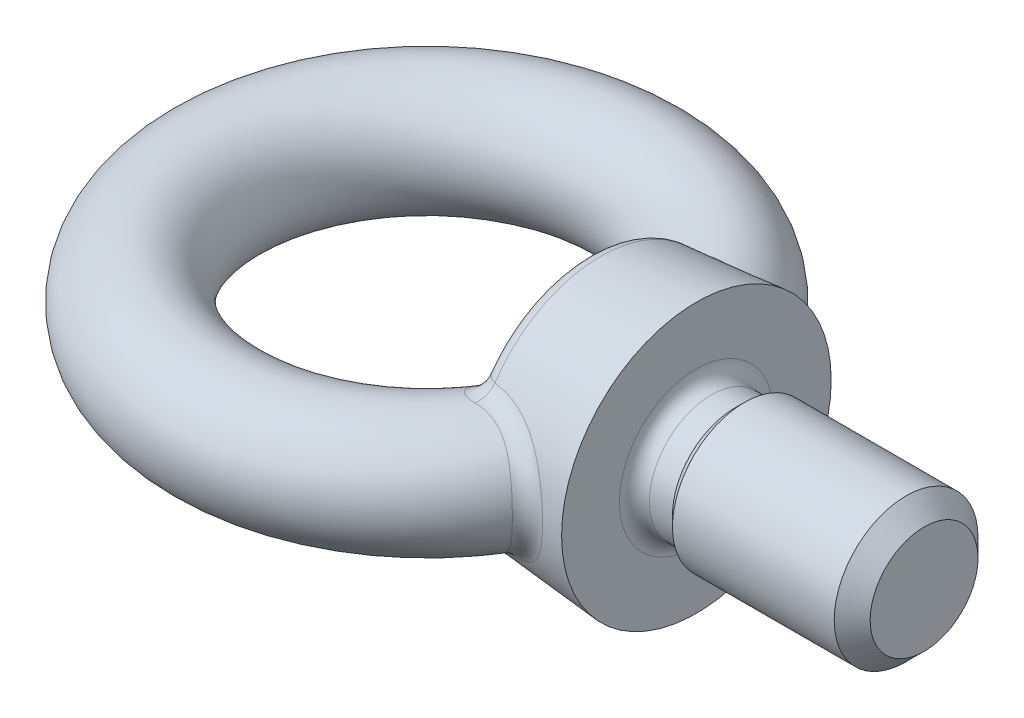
SolidWorks part; units mm, degrees
ref_plane "Front Plane" through (0, 0, 0) normal (0, 0, 1) x (1, 0, 0)
ref_plane "Top Plane" through (0, 0, 0) normal (0, 1, 0) x (1, 0, 0)
ref_plane "Right Plane" through (0, 0, 0) normal (1, 0, 0) x (0, 0, -1)
sketch "BaseBodySke" plane through (0, 0, 0) normal (0, 0, 1) x (1, 0, 0)
  line L0 (-107.4075, 0) -> (214.0904, 0) construction
  line L1 (0, 0) -> (0, 10.352)
  line L2 (8, 12) -> (6.352, 10.352)
  line L3 (6.352, 10.352) -> (0, 10.352)
  line L4 (8, 12) -> (38, 12)
  line L5 (38, 12) -> (38, 0)
  line L6 (38, 0) -> (0, 0)
  line L7 (8, 24.2031) -> (8, -17.9005) construction
  line L8 (34.0602, 10.352) -> (57.5082, 10.352) construction
  line L9 (35, 13.8049) -> (35, -14.5195) construction
  dimension "D2" = 45
  dimension "Diameter" = 24
  dimension "Length" = 38
  dimension "Thread_length" = 30
  dimension "Minor_dia" = 20.704
  dimension "Advance" = 3
  dimension "Slot_width" = 8
revolve "BaseBody" add sketch "BaseBodySke" angle 360 about L6
sketch "HeadBaseSke" plane through (0, 0, 0) normal (0, 0, 1) x (1, 0, 0)
  line L0 (0, 0) -> (-36.296, 0) construction
  line L1 (-18, 20.9252) -> (0, 22.5)
  line L2 (-20, 0) -> (0, 0)
  line L3 (-45, 33.5024) -> (-45, -15.844) construction
  line L4 (0, 22.5) -> (0, 0)
  line L5 (-20, 0) -> (-18, 20.9252)
  dimension "D2" = 5
  dimension "Head_height" = 18
  dimension "Base_diameter" = 45
  dimension "Center_height" = 45
  dimension "Diameter_b" = 50
revolve "HeadBase" add sketch "HeadBaseSke" angle 360 about L0
sketch "RingSke" plane through (0, 0, 0) normal (0, 0, 1) x (1, 0, 0)
  line L0 (-45, 45.564) -> (-45, -44.2909) construction
  line L1 (0, 29.3194) -> (0, -32.008) construction
  circle A0 centre (-10, 0) radius 10
  dimension "D1" = 45
  dimension "Diameter_a" = 90
revolve "Ring" add sketch "RingSke" angle 360 about L0
sketch "FlatEndSke" plane through (0, 0, 0) normal (0, 0, 1) x (1, 0, 0)
  line L0 (35, 12) -> (38, 12)
  line L1 (38, 12) -> (38, 9)
  line L2 (38, 9) -> (35, 12)
  line L3 (38, -12) -> (38, 12) construction
  line L5 (0, 0) -> (89.7899, 0) construction
  dimension "D1" = 45
  dimension "Chamfer_width" = 3
revolve "FlatEnd" cut sketch "FlatEndSke" angle 360 about L5
sketch "CutEndSke" plane through (38, 0, 0) normal (1, 0, 0) x (0, 0, -1)
  circle A0 centre (0, 0) radius 12 construction
  circle A1 centre (0, 0) radius 12
extrude "CutEnd" [suppressed] cut sketch "CutEndSke" against normal blind 3
dome "RoundEnd" [suppressed] faces to dome 1 distance 3 parameters "D1"=3
fillet "Fillet1" radius 2.4 6 edges at (-18, 20.9252, 0) (-18, -20.9252, 0) (-19.811, 1.9468, -0.3451) (-19.811, -1.9468, 0.3451) (-5.8247, -1.3824, 21.9469) (-5.8247, 1.3824, -21.9469)
fillet "Fillet2" radius 3.6 8 edges at (-17.4293, 9.7808, 17.9838) (-17.5159, 9.7551, -17.9021) (-19.811, 1.9468, -0.3451) (-5.8247, -1.3824, 21.9469) (-5.8247, 1.3824, -21.9469) (-17.5159, -9.7551, 17.9021) (-17.4293, -9.7808, -17.9838) (-19.811, -1.9468, 0.3451)
fillet "Fillet" radius 2.5 1 edges at (0, 0, -10.352)
sketch "ThdSchSke" plane through (0, 0, 0) normal (0, 0, 1) x (1, 0, 0)
  line L0 (0, 0) -> (89.8666, 0) construction
  line L1 (38, -27.1828) -> (38, 30.5493) construction
  line L2 (35, 10.352) -> (34.0485, 12)
  line L3 (34.0485, 12) -> (34.0485, 13.9029)
  line L4 (34.0485, 13.9029) -> (35.9515, 13.9029)
  line L5 (35.9515, 13.9029) -> (35.9515, 12)
  line L6 (35.9515, 12) -> (35, 10.352)
  dimension "D1" = 20.704
  dimension "Length" = 38
  dimension "Advance" = 3
  dimension "D2" = 24
revolve "ThreadSchematic" [suppressed] cut sketch "ThdSchSke" angle 360 about L0
pattern_linear "ThdSchPat" [suppressed] count 10 spacing 3 along (1, 0, 0)
equation "\"Thread_length@BaseBodySke\" = \"Length@BaseBodySke\" - \"Slot_width@BaseBodySke\""
equation "\"Thread_minor@ThreadCosmetic\" = \"Minor_dia@BaseBodySke\""
equation "\"Thread_length@ThreadCosmetic\" = \"Thread_length@BaseBodySke\""
equation "\"D1@RingSke\" = \"Center_height@HeadBaseSke\""
equation "\"D1@CutEnd\" = \"Chamfer_width@FlatEndSke\""
equation "\"D1@RoundEnd\" = \"Chamfer_width@FlatEndSke\""
equation "\"D1@Fillet1\" = \"Diameter@BaseBodySke\"/10"
equation "\"D1@Fillet2\" = \"D1@Fillet1\"*1.5"
equation "\"Length@ThdSchSke\" = \"Length@BaseBodySke\""
equation "\"Advance@ThdSchSke\" = \"Advance@BaseBodySke\""
equation "\"D2@ThdSchSke\" = \"Diameter@BaseBodySke\""
equation "\"D1@ThdSchSke\" = \"Minor_dia@BaseBodySke\""
equation "\"D3@ThdSchPat\" = \"Advance@BaseBodySke\""
equation "\"D1@ThdSchPat\" =  int( \"Thread_length@BaseBodySke\" / \"Advance@BaseBodySke\" ) "
